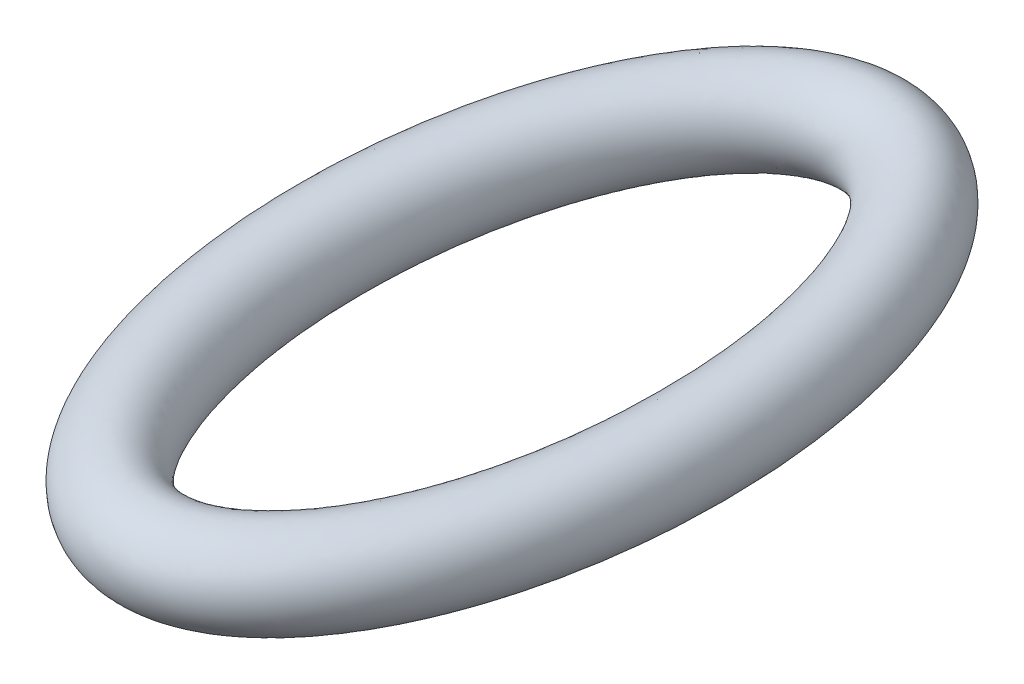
SolidWorks part; units mm, degrees
ref_plane "正面" through (0, 0, 0) normal (0, 0, 1) x (1, 0, 0)
ref_plane "平面" through (0, 0, 0) normal (0, 1, 0) x (1, 0, 0)
ref_plane "右側面" through (0, 0, 0) normal (1, 0, 0) x (0, 0, -1)
sketch "ｽｹｯﾁ1" plane through (0, 0, 0) normal (0, 1, 0) x (1, 0, 0)
  ellipse E0 centre (0, 0) end of major axis (0, 80) minor radius 40
  dimension "D1" = 160
  dimension "D2" = 80
sketch "ｽｹｯﾁ2" plane through (0, 0, 0) normal (0, 0, 1) x (1, 0, 0)
  circle A0 centre (40, 0) radius 10
  dimension "D1" = 20
sweep "ｽｲｰﾌﾟ1" add profiles "ｽｹｯﾁ2" path "ｽｹｯﾁ1"
